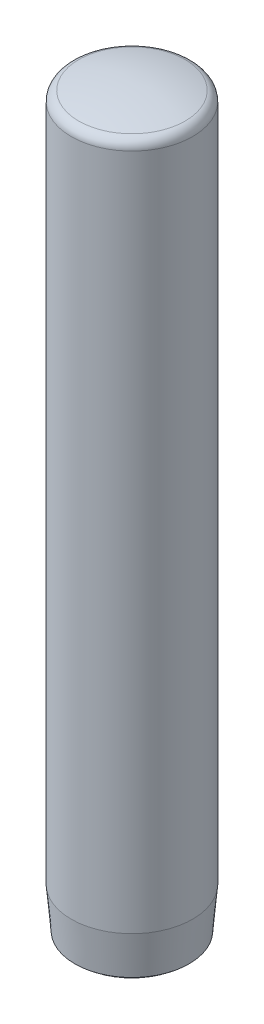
SolidWorks part; units mm, degrees
ref_plane "Plan1" through (0, 0, 0) normal (0, 0, 1) x (1, 0, 0)
ref_plane "Plan2" through (0, 0, 0) normal (0, 1, 0) x (1, 0, 0)
ref_plane "Plan3" through (0, 0, 0) normal (1, 0, 0) x (0, 0, -1)
sketch "Esquisse1" plane through (0, 0, 0) normal (0, 0, 1) x (1, 0, 0)
  line L0 (0, 27.3348) -> (0, -40) construction
  line L1 (-2.825, 1) -> (-3, 3)
  line L2 (-3, 3) -> (-3, 36.5)
  line L3 (0, 37.3348) -> (0, 0)
  arc A0 (0, 0) -> (-2.825, 1) centre (-0.1104, 4.1785) cw
  arc A2 (-2.6316, 36.9824) -> (-3, 36.5) centre (-2.5, 36.5) ccw
  arc A3 (0, 37.3348) -> (-2.6316, 36.9824) centre (0, 27.3348) ccw
  dimension "D1" = 4.18
  dimension "D2" = 1
  dimension "D8" = 10
  dimension "D3" = 5.65
  dimension "D4" = 6
  dimension "D5" = 1
  dimension "D6" = 2
  dimension "D7" = 33.5
revolve "Base-Révolution" add sketch "Esquisse1" angle 360 about L0
ref_plane "Plan4" through (0, 18.5, 0) normal (0, 1, 0) x (-1, 0, 0)
